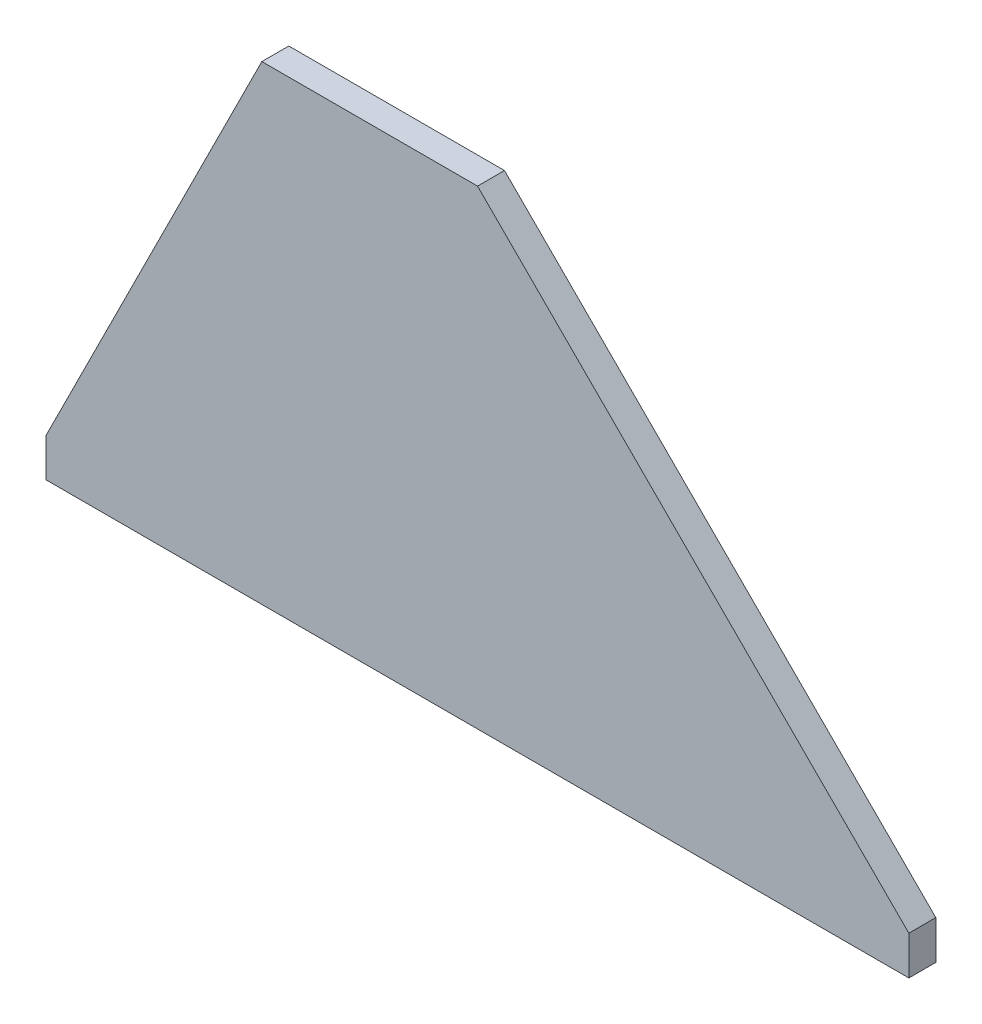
SolidWorks part; units mm, degrees
ref_plane "Front Plane" through (0, 0, 0) normal (0, 0, 1) x (1, 0, 0)
ref_plane "Top Plane" through (0, 0, 0) normal (0, 1, 0) x (1, 0, 0)
ref_plane "Right Plane" through (0, 0, 0) normal (1, 0, 0) x (0, 0, -1)
sketch "Sketch2" plane through (0, 0, 0) normal (0, 0, 1) x (1, 0, 0)
  line L1 (101.6, 0) -> (50.8, 50.8)
  line L2 (50.8, 50.8) -> (25.4, 50.8)
  line L3 (25.4, 50.8) -> (0, 0)
  line L4 (101.6, 0) -> (101.6, -4.572)
  line L5 (0, -4.572) -> (0, 0)
  line L6 (0, -4.572) -> (101.6, -4.572)
  dimension "D1" = 4.572
  dimension "D2" = 50.8
  dimension "D3" = 25.4
  dimension "D4" = 50.8
extrude "Extrude1" add sketch "Sketch2" along normal blind 3.175
